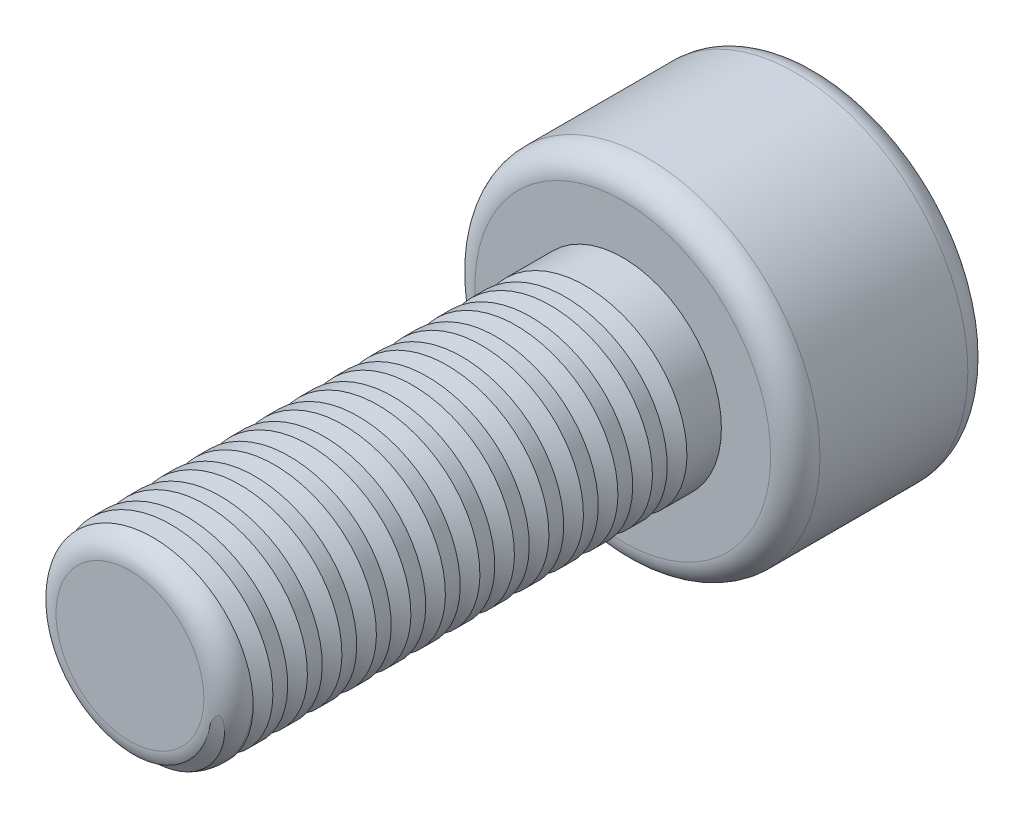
SolidWorks part; units mm, degrees
ref_plane "前视基准面" through (0, 0, 0) normal (0, 0, 1) x (1, 0, 0)
ref_plane "上视基准面" through (0, 0, 0) normal (0, 1, 0) x (1, 0, 0)
ref_plane "右视基准面" through (0, 0, 0) normal (1, 0, 0) x (0, 0, -1)
sketch "草图1" plane through (0, 0, 0) normal (0, 0, 1) x (1, 0, 0)
  circle A0 centre (0, 0) radius 3.5
extrude "凸台-拉伸1" add sketch "草图1" along normal blind 4
sketch "草图2" plane through (0, 0, 4) normal (0, 0, 1) x (1, 0, 0)
  circle A0 centre (0, 0) radius 2
extrude "凸台-拉伸2" add sketch "草图2" along normal blind 10
fillet "圆角1" radius 0.5 1 edges at (2, 0, 14)
sketch "草图3" plane through (0, 0, 14) normal (0, 0, 1) x (1, 0, 0)
  circle A0 centre (0, 0) radius 1.65
curve "螺旋线/涡状线1"
sketch "草图4" plane through (0, 0, 0) normal (0, 1, 0) x (1, 0, 0)
  line L0 (1.4611, -14.0027) -> (3.2417, -14.0027) construction
  line L2 (1.6543, -14.0027) -> (2.6347, -14.5688)
  line L3 (2.6347, -14.5688) -> (2.6347, -13.4367)
  line L4 (2.6347, -13.4367) -> (1.6543, -14.0027)
  circle A0 centre (2.3079, -14.0027) radius 0.3268 construction
sweep "切除-扫描1" cut profiles "草图4" path "螺旋线/涡状线1"
sketch "草图5" plane through (0, 0, 0) normal (0, 0, -1) x (-1, 0, 0)
  line L1 (1.7321, 0) -> (0.866, 1.5)
  line L2 (0.866, 1.5) -> (-0.866, 1.5)
  line L3 (-0.866, 1.5) -> (-1.7321, 0)
  line L4 (-1.7321, 0) -> (-0.866, -1.5)
  line L5 (-0.866, -1.5) -> (0.866, -1.5)
  line L6 (0.866, -1.5) -> (1.7321, 0)
  circle A0 centre (0, 0) radius 1.5 construction
  dimension "D1" = 3
extrude "切除-拉伸1" cut sketch "草图5" against normal blind 2
fillet "圆角2" radius 0.5 2 edges at (3.5, 0, 4) (3.5, 0, 0)
